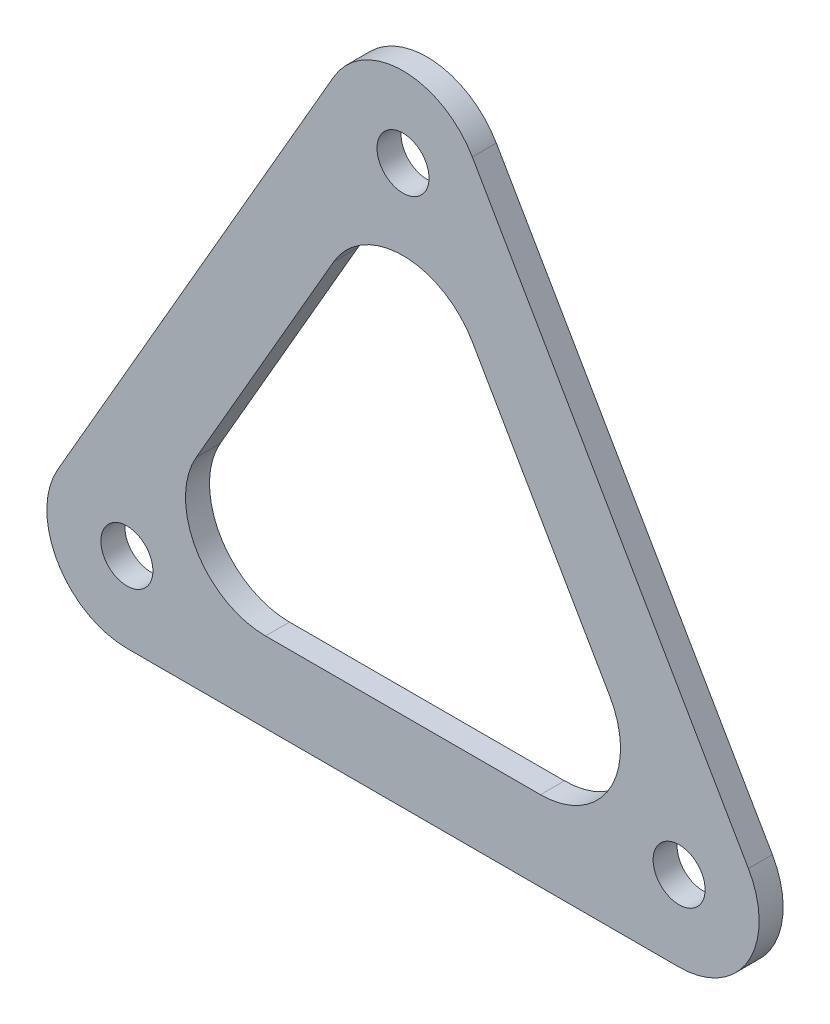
SolidWorks part; units mm, degrees
ref_plane "Front Plane" through (0, 0, 0) normal (0, 0, 1) x (1, 0, 0)
ref_plane "Top Plane" through (0, 0, 0) normal (0, 1, 0) x (1, 0, 0)
ref_plane "Right Plane" through (0, 0, 0) normal (1, 0, 0) x (0, 0, -1)
sketch "Sketch2" plane through (0, 0, 0) normal (0, 0, 1) x (1, 0, 0)
  line L0 (0, 0) -> (69, 0) construction
  line L1 (69, 0) -> (34.5, 59.7558) construction
  line L2 (34.5, 59.7558) -> (0, 0) construction
  line L3 (86.3205, -10) -> (34.5, 79.7558)
  line L4 (34.5, 79.7558) -> (-17.3205, -10)
  line L5 (-17.3205, -10) -> (86.3205, -10)
  line L6 (25.8397, 44.7558) -> (8.6603, 15)
  line L7 (17.3205, 0) -> (51.6795, 0)
  line L8 (60.3397, 15) -> (43.1603, 44.7558)
  line L9 (34.5, 59.7558) -> (0, 0) construction
  line L10 (69, 0) -> (34.5, 59.7558) construction
  line L11 (0, 0) -> (69, 0) construction
  circle A0 centre (34.5, 59.7558) radius 3.25
  circle A1 centre (69, 0) radius 3.25
  circle A2 centre (0, 0) radius 3.25
  arc A3 (25.8397, 44.7558) -> (43.1603, 44.7558) centre (34.5, 39.7558) cw
  arc A4 (17.3205, 0) -> (8.6603, 15) centre (17.3205, 10) cw
  arc A5 (60.3397, 15) -> (51.6795, 0) centre (51.6795, 10) cw
  dimension "D4" = 6.5
  dimension "D7" = 10
  dimension "D1" = 69
  dimension "D2" = 69
  dimension "D3" = 69
  dimension "D5" = 10
  dimension "D6" = 10
extrude "Extrude1" add sketch "Sketch2" along normal blind 3
fillet "Fillet1" radius 10 3 edges at (-17.3205, -10, 1.5) (86.3205, -10, 1.5) (34.5, 79.7558, 1.5)
